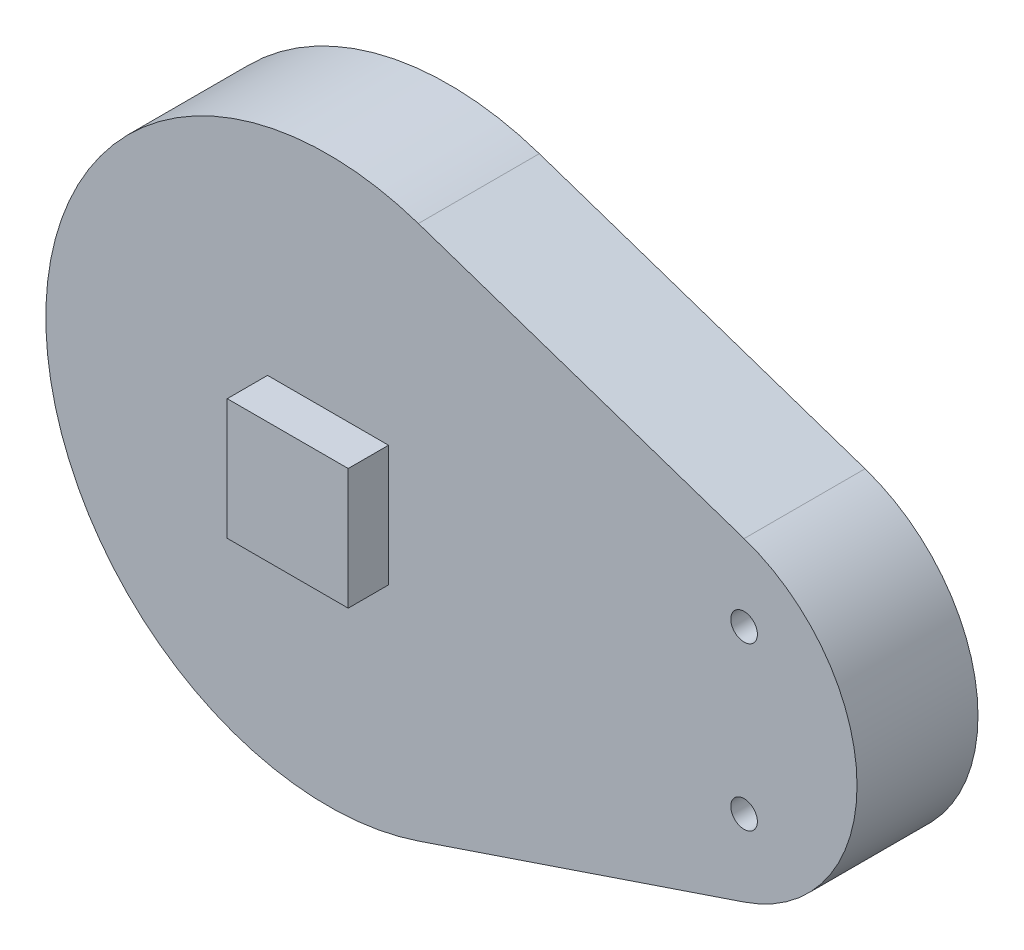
SolidWorks part; units mm, degrees
ref_plane "Płaszczyzna przednia" through (0, 0, 0) normal (0, 0, 1) x (1, 0, 0)
ref_plane "Płaszczyzna górna" through (0, 0, 0) normal (0, 1, 0) x (1, 0, 0)
ref_plane "Płaszczyzna prawa" through (0, 0, 0) normal (1, 0, 0) x (0, 0, -1)
sketch "Szkic1" plane through (0, 0, 0) normal (0, 0, 1) x (1, 0, 0)
  line L0 (45.0324, 65.8874) -> (-35.7516, 93.173)
  line L1 (31.8484, 26.8538) -> (-9.3516, 26.8538) construction
  line L2 (45.0324, -12.1798) -> (-35.7516, -39.4655)
  arc A0 (-35.7516, 93.173) -> (-35.7516, -39.4655) centre (-58.1516, 26.8538) ccw
  arc A1 (45.0324, -12.1798) -> (45.0324, 65.8874) centre (31.8484, 26.8538) ccw
  dimension "D1" = 140
  dimension "D2" = 90
extrude "Dodanie-wyciągnięcie1" add sketch "Szkic1" against normal blind 30
sketch "Szkic2" plane through (0, 0, 0) normal (0, 0, 1) x (1, 0, 0)
  line L1 (-43.1516, 11.8538) -> (-73.1516, 11.8538)
  line L2 (-43.1516, 11.8538) -> (-43.1516, 41.8538)
  line L3 (-43.1516, 41.8538) -> (-73.1516, 41.8538)
  line L4 (-73.1516, 11.8538) -> (-73.1516, 41.8538)
  line L5 (-43.1516, 11.8538) -> (-73.1516, 41.8538) construction
  line L6 (-43.1516, 41.8538) -> (-73.1516, 11.8538) construction
  point P0 (-58.1516, 26.8538)
  dimension "D1" = 30
  dimension "D2" = 30
extrude "Dodanie-wyciągnięcie2" add sketch "Szkic2" along normal blind 10
sketch "Szkic3" plane through (0, 0, -30) normal (0, 0, -1) x (-1, 0, 0)
  circle A0 centre (58.1516, 26.8538) radius 65
extrude "Dodanie-wyciągnięcie3" add sketch "Szkic3" along normal blind 3
sketch "Szkic4" plane through (0, 0, -30) normal (0, 0, -1) x (-1, 0, 0)
  line L0 (-45.0324, -12.1798) -> (-45.0324, 65.8874) construction
  line L1 (-45.0324, 65.8874) -> (-73.0484, 26.8538) construction
  line L2 (-73.0484, 26.8538) -> (-45.0324, 6.7456) construction
  arc A0 (-45.0324, 65.8874) -> (-45.0324, -12.1798) centre (-31.8484, 26.8538) ccw construction
  point P10 (-45.0324, 6.7456)
hole_wizard "Pogłębienie walcowe pod M6 Śrubę z łbem stożkowym ściętym1" positions "Szkic 3D1" profile "Szkic5" counterbore size "M6" standard "ISO"
sketch3d "Szkic 3D1"
  point P0 (45.0324, 6.7456, -30)
sketch "Szkic5" plane through (45.0324, 6.7456, -30) normal (1, 0, 0) x (0, 1, 0)
  line L0 (0, 0) -> (0, 30)
  line L1 (0, 30) -> (3.3, 30)
  line L3 (3.3, 30) -> (3.3, 4.6)
  line L4 (3.3, 4.6) -> (6.5, 4.6)
  line L5 (6.5, 4.6) -> (6.5, 0)
  line L7 (6.5, 0) -> (0, 0)
  line L11 (0, -6.35) -> (0, 107.95) construction
  dimension "Średnica otworu na wylot" = 6.6
  dimension "Głębokość otworu na wylot" = 30
  dimension "Średnica pogłębienia walcowego" = 13
  dimension "Głębokość pogłębienia walcowego" = 4.6
sketch "Szkic6" plane through (0, 0, -30) normal (0, 0, -1) x (-1, 0, 0)
  line L0 (-45.0324, -12.1798) -> (-45.0324, 65.8874) construction
  line L1 (-45.0324, 65.8874) -> (-73.0484, 26.8538) construction
  line L2 (-73.0484, 26.8538) -> (-45.0324, 46.962) construction
  line L5 (-73.0484, 26.8538) -> (-45.0324, 6.7456) construction
  line L6 (-45.0324, 6.7456) -> (-45.0324, 26.8538) construction
  line L7 (-45.0324, 26.8538) -> (-73.0484, 26.8538) construction
  point P8 (-45.0324, 46.962)
hole_wizard "Pogłębienie walcowe pod M6 Śrubę z łbem stożkowym ściętym2" positions "Szkic 3D2" profile "Szkic7" counterbore size "M6" standard "ISO"
sketch3d "Szkic 3D2"
  point P0 (45.0324, 46.962, -30)
sketch "Szkic7" plane through (45.0324, 46.962, -30) normal (1, 0, 0) x (0, 1, 0)
  line L0 (0, 0) -> (0, 30)
  line L1 (0, 30) -> (3.3, 30)
  line L3 (3.3, 30) -> (3.3, 4.6)
  line L4 (3.3, 4.6) -> (6.5, 4.6)
  line L5 (6.5, 4.6) -> (6.5, 0)
  line L7 (6.5, 0) -> (0, 0)
  line L11 (0, -6.35) -> (0, 107.95) construction
  dimension "Średnica otworu na wylot" = 6.6
  dimension "Głębokość otworu na wylot" = 30
  dimension "Średnica pogłębienia walcowego" = 13
  dimension "Głębokość pogłębienia walcowego" = 4.6
fillet "Zaokrąglenie2" radius 1 2 edges at (38.5324, 46.962, -30) (38.5324, 6.7456, -30)
sketch "Szkic8" plane through (0, 0, -33) normal (0, 0, -1) x (-1, 0, 0)
  circle A0 centre (58.1516, 26.8538) radius 30
extrude "Wytnij-wyciągnięcie1" cut sketch "Szkic8" against normal blind 10
